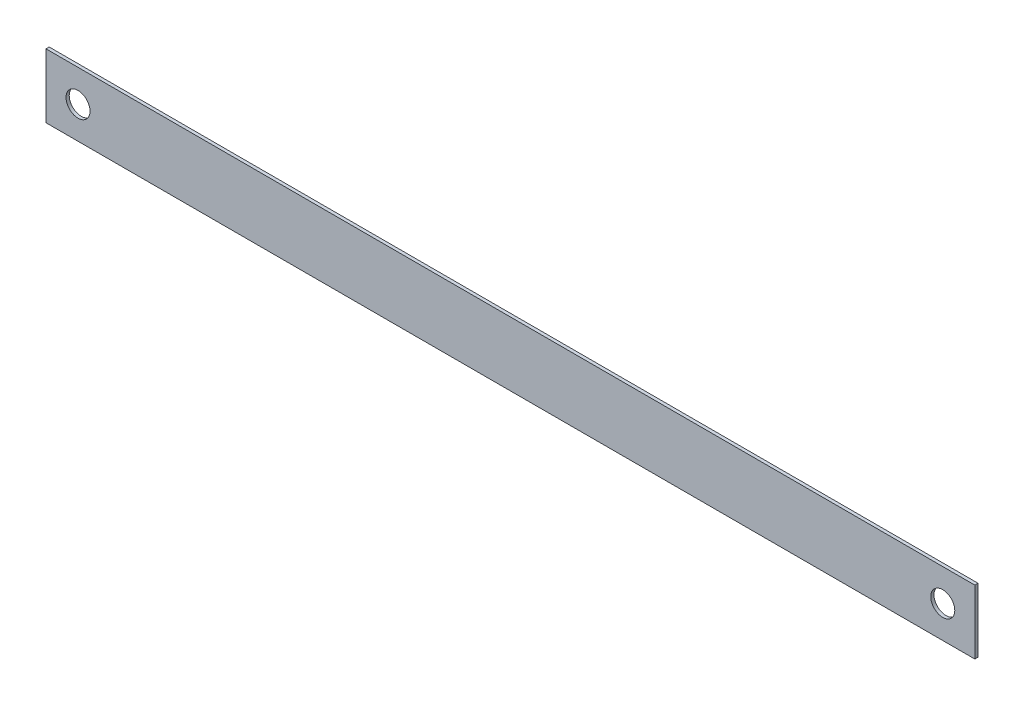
SolidWorks part; units mm, degrees
ref_plane "Front" through (0, 0, 0) normal (0, 0, 1) x (1, 0, 0)
ref_plane "Top" through (0, 0, 0) normal (0, 1, 0) x (1, 0, 0)
ref_plane "Right" through (0, 0, 0) normal (1, 0, 0) x (0, 0, -1)
sketch "Sketch1" plane through (0, 0, 0) normal (0, 0, 1) x (1, 0, 0)
  line L0 (-145, 10) -> (145, 10)
  line L1 (-145, 10) -> (-145, -10)
  line L2 (145, -10) -> (-145, -10)
  line L3 (145, -10) -> (145, 10)
  line L4 (145, 10) -> (-145, -10) construction
  line L5 (-145, 10) -> (145, -10) construction
  point P4 (0, 0)
  dimension "D1" = 290
  dimension "D2" = 20
extrude "Base-Extrude" add sketch "Sketch1" along normal blind 1
sketch "Sketch2" plane through (0, 0, 1) normal (0, 0, 1) x (1, 0, 0)
  line L0 (145, 0) -> (129.7802, 0) construction
  line L1 (145, -10) -> (145, 10) construction
  circle A0 centre (135, 0) radius 3.75
  dimension "D1" = 7.5
  dimension "D2" = 10
extrude "Cut-Extrude1" cut sketch "Sketch2" against normal through all
mirror "Mirror1" about plane through (0, 0, 0) normal (1, 0, 0)
